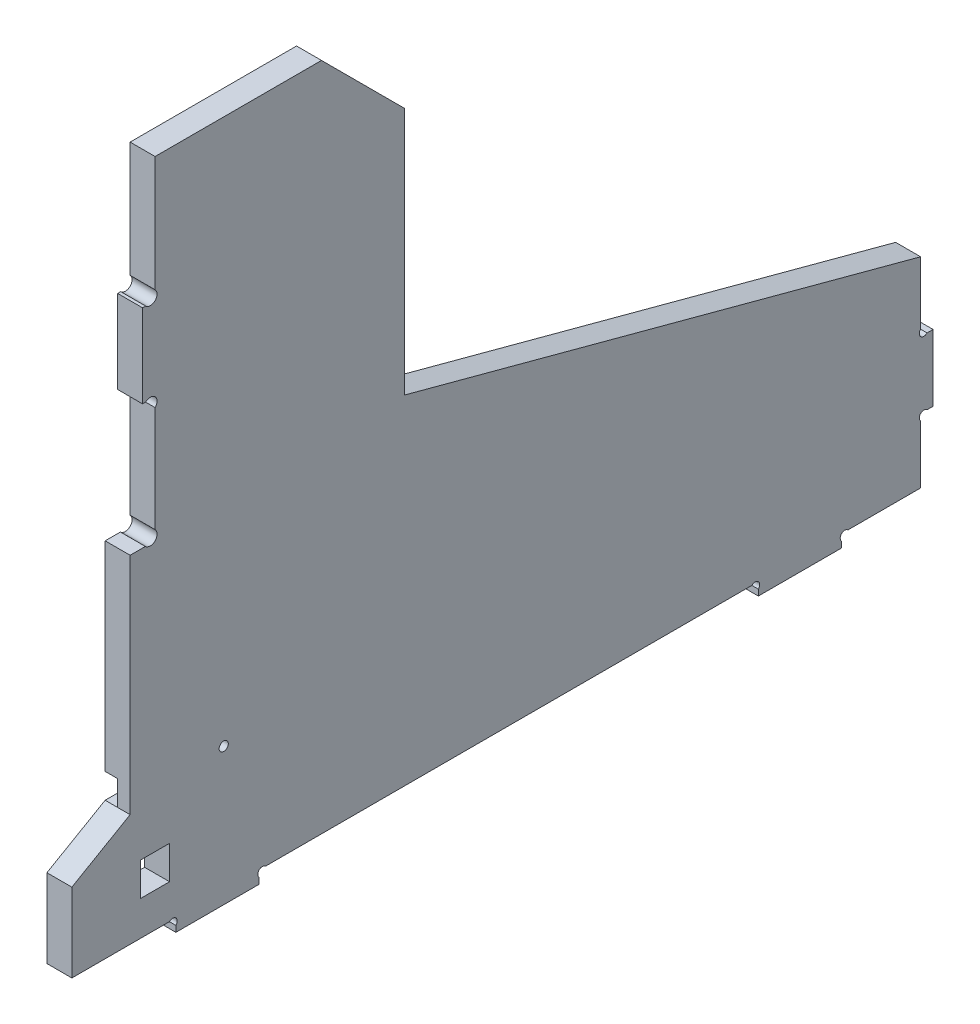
SolidWorks part; units mm, degrees
ref_plane "Plan de face" through (0, 0, 0) normal (0, 0, 1) x (1, 0, 0)
ref_plane "Plan de dessus" through (0, 0, 0) normal (0, 1, 0) x (1, 0, 0)
ref_plane "Plan de droite" through (0, 0, 0) normal (1, 0, 0) x (0, 0, -1)
sketch "Esquisse1" plane through (0, 0, 0) normal (1, 0, 0) x (0, 0, -1)
  line L0 (0, -10.3129) -> (0, 191.2158) construction
  line L1 (-27.1936, 0) -> (214.3341, 0) construction
  line L2 (207, -15.5234) -> (207, 186.2154) construction
  line L3 (105, -15.5234) -> (105, 6.2979) construction
  line L4 (17, 137.2152) -> (17, 104.3661) construction
  line L5 (20, 164) -> (20, 136.2627)
  line L6 (0, 21.9171) -> (0, 3)
  line L7 (-27.1936, 30) -> (200.5597, 30) construction
  line L8 (-10.2862, 124) -> (23.4444, 124) construction
  line L9 (5.4347, 134) -> (24.048, 134) construction
  line L10 (60, 164) -> (80, 144) construction
  line L11 (214.3341, 164) -> (-7.6552, 164) construction
  line L12 (60, 164) -> (80, 144)
  line L13 (185, 3) -> (195.7444, -7.7444) construction
  line L14 (185, 1.4444) -> (185, 0)
  line L15 (80, 144) -> (80, 84.3557)
  line L16 (20, 134) -> (8.5345, 145.4655) construction
  line L17 (185, 0) -> (165, 0)
  line L18 (20, 164) -> (60, 164)
  line L19 (165, 0) -> (165, 1.4444)
  line L20 (186.5556, 3) -> (204, 3)
  line L21 (204, 3) -> (-12.7537, 3) construction
  line L22 (45, 0) -> (45, 1.4444)
  line L23 (25, 0) -> (45, 0)
  line L24 (25, 1.4444) -> (25, 0)
  line L25 (46.5556, 3) -> (163.4444, 3)
  line L26 (187, 26.5) -> (198.6582, 26.5) construction
  line L27 (198.6582, 18.5) -> (181.0711, 18.5) construction
  line L28 (204, 18.5) -> (215.3091, 7.1909) construction
  line L29 (205.5556, 34.5) -> (207, 34.5)
  line L30 (205.5556, 18.5) -> (207, 18.5)
  line L31 (204, 16.9444) -> (204, 3)
  line L32 (204, 36.0556) -> (204, 51.13)
  line L33 (207, 34.5) -> (207, 18.5)
  line L34 (-12.7537, 11.3) -> (40.6336, 11.3) construction
  line L35 (20, 65.49) -> (20, 173.6999) construction
  line L36 (-10.2862, 84) -> (23.4444, 84) construction
  line L37 (17.7373, 134) -> (17, 134)
  line L38 (80, 77.5865) -> (80, 173.6999) construction
  line L39 (14, 85.8493) -> (14, 36.0556) construction
  line L40 (20, 84) -> (6.6038, 97.3962) construction
  line L41 (14, 30) -> (14, 84)
  line L42 (14, 30) -> (0, 21.9171)
  line L43 (204, 3) -> (204, 70.5) construction
  line L44 (204, 51.13) -> (80, 84.3557)
  line L45 (17, 134) -> (17, 114)
  line L46 (17, 114) -> (17.7373, 114)
  line L47 (20, 111.7373) -> (20, 86.3335)
  line L48 (14, 84) -> (17.6665, 84)
  line L49 (9.8882, 33) -> (53.631, 33) construction
  line L50 (19.98, 19.513) -> (19.98, 59.3166) construction
  line L51 (40.6336, 19.3) -> (-12.7537, 19.3) construction
  line L52 (16.48, 39.3623) -> (16.48, 66.3531) construction
  line L53 (23.48, 39.3623) -> (23.48, 66.3531) construction
  line L54 (0, 3) -> (23.4444, 3)
  line L55 (185, -15.5234) -> (185, 7.1909) construction
  line L57 (175, 6.2979) -> (175, -4.4633) construction
  line L58 (16.48, 19.3) -> (23.48, 19.3)
  line L59 (16.48, 19.3) -> (16.48, 11.3)
  line L60 (16.48, 11.3) -> (23.48, 11.3)
  line L61 (23.48, 19.3) -> (23.48, 11.3)
  arc A0 (17.7373, 134) -> (20, 136.2627) centre (18.8686, 135.1314) ccw
  arc A1 (17.7373, 114) -> (20, 111.7373) centre (18.8686, 112.8686) cw
  arc A2 (186.5556, 3) -> (185, 1.4444) centre (185.7778, 2.2222) ccw
  arc A3 (163.4444, 3) -> (165, 1.4444) centre (164.2222, 2.2222) cw
  arc A4 (46.5556, 3) -> (45, 1.4444) centre (45.7778, 2.2222) ccw
  arc A5 (23.4444, 3) -> (25, 1.4444) centre (24.2222, 2.2222) cw
  arc A6 (205.5556, 18.5) -> (204, 16.9444) centre (204.7778, 17.7222) ccw
  arc A7 (205.5556, 34.5) -> (204, 36.0556) centre (204.7778, 35.2778) cw
  arc A9 (17.6665, 84) -> (20, 86.3335) centre (18.8333, 85.1667) ccw
  circle A10 centre (36.5, 33) radius 1.1
  dimension "D15" = 3
  dimension "D23" = 3
  dimension "D12" = 10
  dimension "D13" = 8
  dimension "D16" = 60
  dimension "D11" = 6
  dimension "D18" = 45
  dimension "D20" = 40
  dimension "D21" = 5.98
  dimension "D24" = 8
  dimension "D3" = 22
  dimension "D27" = 120
  dimension "D2" = 207
  dimension "D4" = 45
  dimension "D5" = 3
  dimension "D6" = 30
  dimension "D7" = 40
  dimension "D8" = 48.13
  dimension "D9" = 45
  dimension "D10" = 134
  dimension "D14" = 45
  dimension "D17" = 45
  dimension "D19" = 10
  dimension "D22" = 3
  dimension "D25" = 80
  dimension "D26" = 7
  dimension "D28" = 105
  dimension "D29" = 8.3
  dimension "D30" = 3.5
extrude "Boss.-Extru.1" add sketch "Esquisse1" along normal blind 6
sketch "Esquisse2" plane through (0, 0, 0) normal (1, 0, 0) x (0, 0, -1)
  line L0 (-21.321, 3) -> (210.4558, 3) construction
  line L1 (-21.321, 30) -> (94.5674, 30) construction
  line L2 (14, 103.5087) -> (14, -14.2603) construction
  line L3 (59, 103.5087) -> (59, -14.2603) construction
  line L4 (-21.321, 36) -> (75.4362, 36) construction
  line L5 (5.4648, 33) -> (75.4362, 33) construction
  line L6 (59, 30) -> (40.5881, 48.4119) construction
  line L7 (59, 33.8787) -> (59, 32.1213)
  line L8 (14, 36) -> (14, 30)
  line L9 (14, 30) -> (56.8787, 30)
  line L10 (14, 36) -> (56.8787, 36)
  arc A0 (56.8787, 30) -> (59, 32.1213) centre (57.9393, 31.0607) ccw
  arc A1 (56.8787, 36) -> (59, 33.8787) centre (57.9393, 34.9393) cw
  dimension "D1" = 27
  dimension "D2" = 3
  dimension "D3" = 6
  dimension "D4" = 45
  dimension "D5" = 45
extrude "Enlèv. mat.-Extru.1" cut sketch "Esquisse2" along normal blind 3
